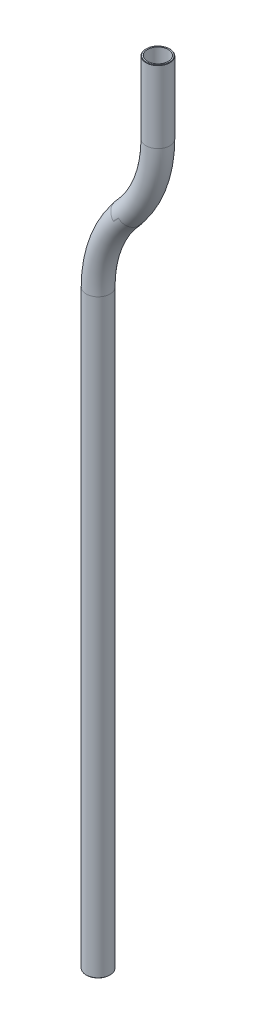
SolidWorks part; units mm, degrees
ref_plane "Plan de face" through (0, 0, 0) normal (0, 0, 1) x (1, 0, 0)
ref_plane "Plan de dessus" through (0, 0, 0) normal (0, 1, 0) x (1, 0, 0)
ref_plane "Plan de droite" through (0, 0, 0) normal (1, 0, 0) x (0, 0, -1)
sketch "Esquisse1" plane through (0, 0, 0) normal (0, 0, 1) x (1, 0, 0)
  line L0 (0, 0) -> (0, 740.6829)
  line L1 (40.5694, 843.274) -> (34.4306, 836.726)
  line L2 (75, 939.3171) -> (75, 1030)
  arc A0 (34.4306, 836.726) -> (75, 939.3171) centre (-75, 939.3171) ccw
  arc A1 (0, 740.6829) -> (40.5694, 843.274) centre (150, 740.6829) cw
  point P7 (75, 880)
  point P10 (0, 800)
  dimension "D5" = 150
  dimension "D1" = 75
  dimension "D2" = 800
  dimension "D3" = 150
  dimension "D4" = 80
sketch "Esquisse2" plane through (0, 0, 0) normal (0, 1, 0) x (1, 0, 0)
  circle A0 centre (0, 0) radius 15
  circle A1 centre (0, 0) radius 13
  dimension "D1" = 30
  dimension "D2" = 2
sweep "Balayage1" add profiles "Esquisse2" path "Esquisse1"
chamfer "Chanfrein1" distance 0.5 angle 45 2 edges at (0, 0, 15) (75, 1030, 15)
equation "\"éàà\"=36.5333"
